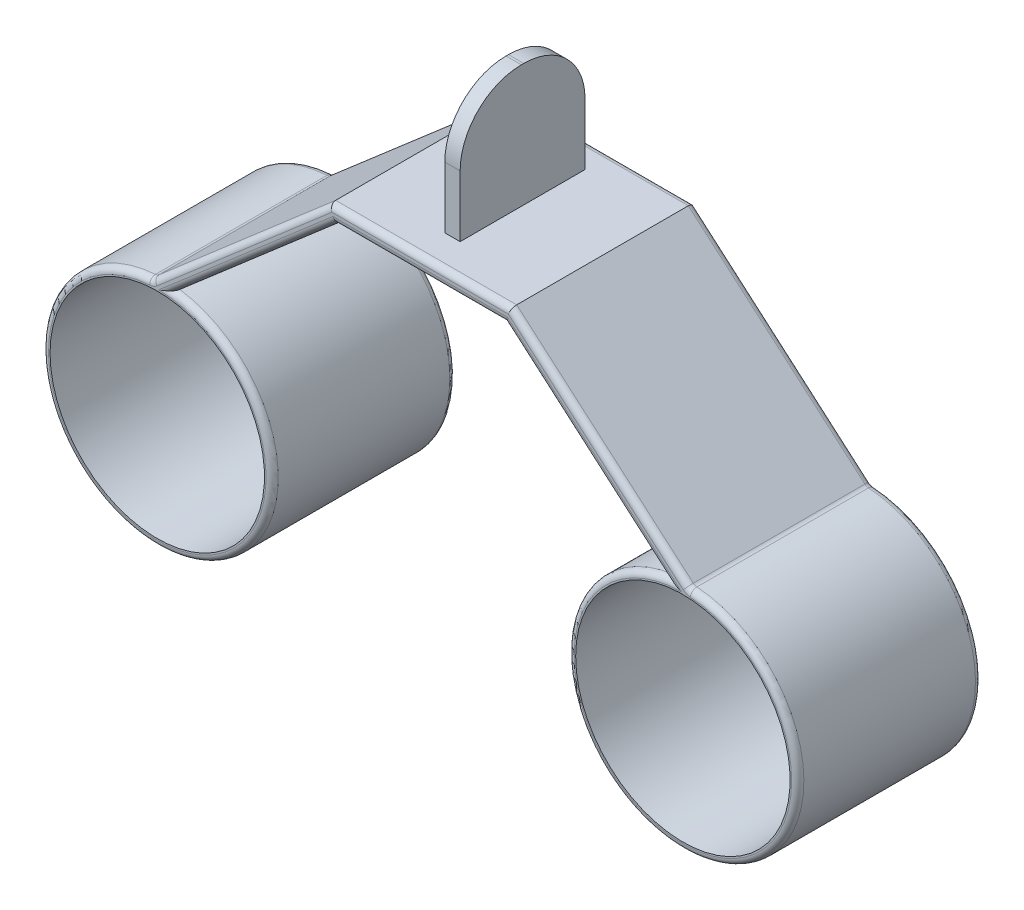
SolidWorks part; units mm, degrees
ref_plane "Front Plane" through (0, 0, 0) normal (0, 0, 1) x (1, 0, 0)
ref_plane "Top Plane" through (0, 0, 0) normal (0, 1, 0) x (1, 0, 0)
ref_plane "Right Plane" through (0, 0, 0) normal (1, 0, 0) x (0, 0, -1)
sketch "Sketch1" plane through (0, 0, 0) normal (0, 0, 1) x (1, 0, 0)
  circle A0 centre (108.9406, 0) radius 44.45
  circle A1 centre (108.9406, 0) radius 47.625
  dimension "D1" = 88.9
  dimension "D2" = 108.9406
  dimension "D3" = 3.175
extrude "Boss-Extrude1" add sketch "Sketch1" along normal blind 76.2
sketch "Sketch2" plane through (0, 0, 76.2) normal (0, 0, 1) x (1, 0, 0)
  line L0 (111.3779, 47.5626) -> (37.5205, 111.4425)
  line L1 (37.5205, 111.4425) -> (0, 111.4425)
  line L2 (0, 111.4425) -> (0, 105.0925)
  line L3 (0, 105.0925) -> (35.1553, 105.0925)
  line L4 (35.1553, 105.0925) -> (102.1598, 47.1398)
  line L6 (102.1598, 47.1398) -> (102.1598, 46.1448)
  line L7 (102.1598, 46.1448) -> (111.3779, 46.1448)
  line L8 (111.3779, 46.1448) -> (111.3779, 47.5626)
  circle A0 centre (108.9406, 0) radius 47.625 construction
  dimension "D1" = 6.35
  dimension "D2" = 6.35
extrude "Boss-Extrude2" add sketch "Sketch2" against normal blind 76.2
mirror "Mirror1" about plane through (0, 0, 0) normal (1, 0, 0) of "Boss-Extrude2", "Boss-Extrude1"
mirror "Mirror2" about plane through (0, 0, 0) normal (1, 0, 0) of "Boss-Extrude1"
fillet "Fillet1" radius 2.54 18 edges at (111.1226, -47.575, 76.2) (111.1226, -47.575, 0) (-111.1226, -47.575, 0) (-111.1226, -47.575, 76.2) (111.3779, 47.5626, 38.1) (-111.3779, 47.5626, 38.1) (74.4492, 79.5025, 76.2) (74.4492, 79.5025, 0) (68.6576, 76.1161, 76.2) (68.6576, 76.1161, 0) (0, 105.0925, 76.2) (0, 105.0925, 0) (0, 111.4425, 76.2) (0, 111.4425, 0) (-68.6576, 76.1161, 76.2) (-74.4492, 79.5025, 76.2) (-74.4492, 79.5025, 0) (-68.6576, 76.1161, 0)
sketch "Sketch3" plane through (0, 111.4425, 0) normal (0, 1, 0) x (1, 0, 0)
  line L0 (-37.5205, -2.54) -> (-37.5205, -73.66) construction
  line L1 (3.1195, -62.7234) -> (-3.2305, -62.7234)
  line L2 (3.1195, -62.7234) -> (3.1195, -10.9366)
  line L3 (3.1195, -10.9366) -> (-3.2305, -10.9366)
  line L4 (-3.2305, -62.7234) -> (-3.2305, -10.9366)
  line L5 (3.1195, -62.7234) -> (-3.2305, -10.9366) construction
  line L6 (3.1195, -10.9366) -> (-3.2305, -62.7234) construction
  line L8 (37.5205, -2.54) -> (-37.5205, -2.54) construction
  point P0 (-0.0555, -36.83)
  dimension "D1" = 6.35
  dimension "D2" = 34.29
  dimension "D3" = 34.29
extrude "Boss-Extrude3" add sketch "Sketch3" along normal blind 50.8
fillet "Fillet2" radius 25.4 2 edges at (-0.0555, 162.2425, 62.7234) (-0.0555, 162.2425, 10.9366)
